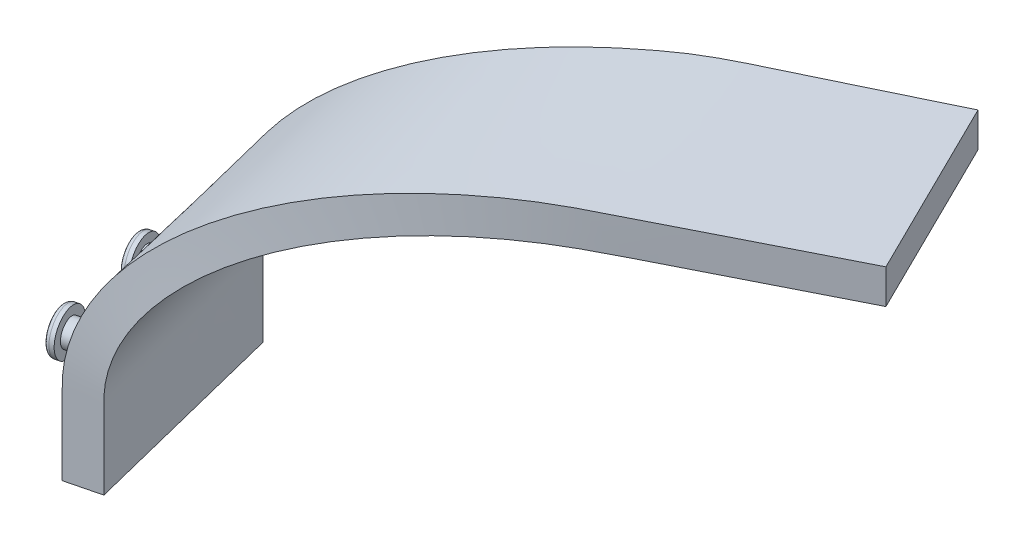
SolidWorks part; units mm, degrees
ref_plane "Front Plane" through (0, 0, 0) normal (0, 0, 1) x (1, 0, 0)
ref_plane "Top Plane" through (0, 0, 0) normal (0, 1, 0) x (1, 0, 0)
ref_plane "Right Plane" through (0, 0, 0) normal (1, 0, 0) x (0, 0, -1)
imported_body "Stock-Binding Start Sketch_&-1"
sketch "Sketch1" plane through (-119.8928, 0, 29.7996) normal (-0.9705, 0, 0.2412) x (0.2412, 0, 0.9705)
  line L0 (38.141, 17) -> (38.141, -6.2619) construction
  line L1 (44.641, 17) -> (31.641, 17) construction
  circle A0 centre (32.141, 9.8312) radius 1.5
  circle A1 centre (44.141, 9.8312) radius 1.5
  arc A2 (45.4528, 7.0835) -> (40.781, 9.5438) centre (38.141, -1.1347) ccw construction
  arc A3 (47.4469, 9.3248) -> (41.501, 12.4562) centre (38.141, -1.1347) ccw construction
  dimension "D1" = 12
extrude "Boss-Extrude1" add sketch "Sketch1" against normal up to next
sketch "Sketch2" plane through (-119.8928, 0, 29.7996) normal (-0.9705, 0, 0.2412) x (0.2412, 0, 0.9705)
  circle A2 centre (32.141, 9.8312) radius 2.5
  circle A3 centre (32.141, 9.8312) radius 2.5
  circle A5 centre (44.141, 9.8312) radius 2.5
  circle A6 centre (44.141, 9.8312) radius 2.5
  dimension "D1" = 1
  dimension "D2" = 1
extrude "Boss-Extrude2" add sketch "Sketch2" along normal blind 1
fillet "Fillet1" radius 0.5 2 edges at (-109.6129, 9.8312, 75.3046) (-112.5074, 9.8312, 63.6589)
